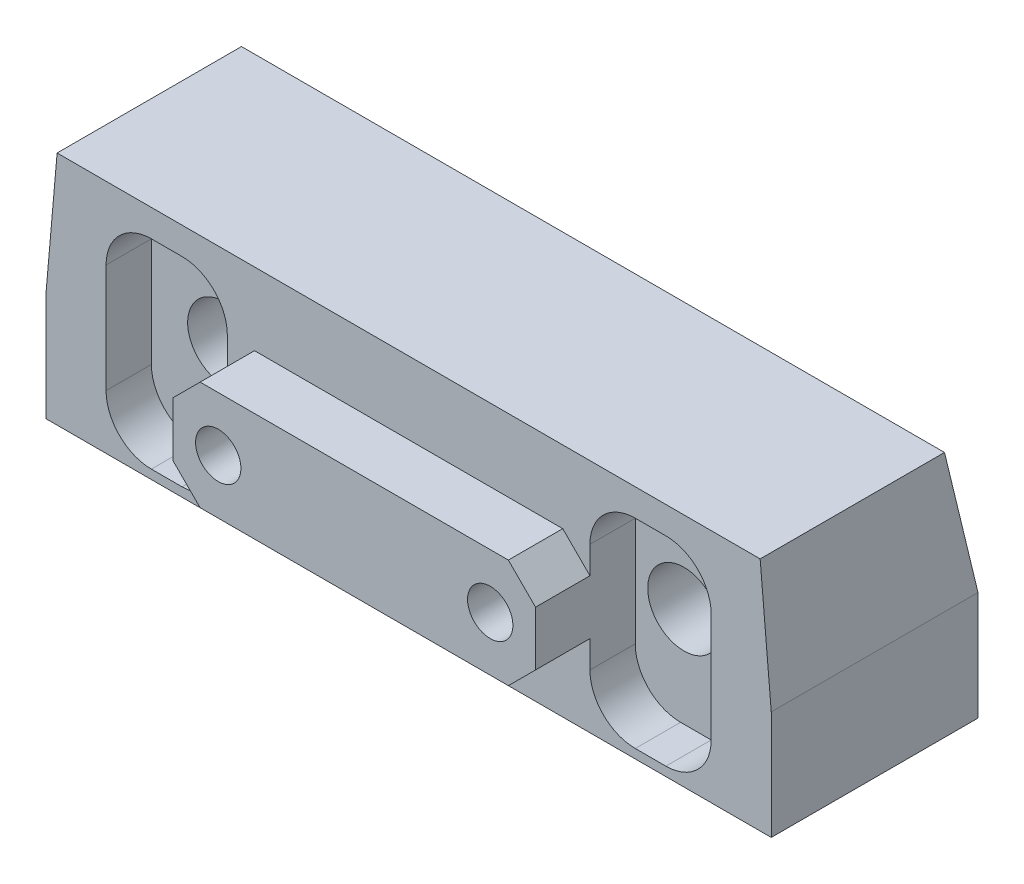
SolidWorks part; units mm, degrees
ref_plane "Plan de face" through (0, 0, 0) normal (0, 0, 1) x (1, 0, 0)
ref_plane "Plan de dessus" through (0, 0, 0) normal (0, 1, 0) x (1, 0, 0)
ref_plane "Plan de droite" through (0, 0, 0) normal (1, 0, 0) x (0, 0, -1)
imported_body "Importée1"
fillet "Congé3" radius 0.5
sketch "Esquisse1" plane through (0, 0, 152) normal (0, 0, 1) x (1, 0, 0)
  line L0 (0, 14) -> (0, -12) construction
  line L1 (-38.7752, 14) -> (38.7752, 14) construction
  line L2 (-26.375, -11) -> (-25, -11)
  line L3 (40, -12) -> (-40, -12) construction
  line L4 (-20, -6) -> (-20, 6)
  line L5 (-25, 11) -> (-26.375, 11)
  line L6 (-26.375, 11) -> (-28.375, 11) construction
  line L7 (-20, 3) -> (-20, -3) construction
  line L8 (-26.375, 11) -> (-26.375, -11)
  line L9 (26.375, 11) -> (26.375, -11)
  line L10 (25, 11) -> (26.375, 11)
  line L11 (20, -6) -> (20, 6)
  line L12 (26.375, -11) -> (25, -11)
  arc A0 (21.375, 6) -> (26.375, 11) centre (26.375, 6) cw construction
  arc A1 (25, -11) -> (20, -6) centre (25, -6) cw
  arc A2 (20, 6) -> (25, 11) centre (25, 6) cw
  arc A3 (-20, 6) -> (-25, 11) centre (-25, 6) ccw
  arc A4 (-21.375, 6) -> (-26.375, 11) centre (-26.375, 6) ccw construction
  arc A5 (-21.375, 6) -> (-26.375, 11) centre (-26.375, 6) ccw construction
  arc A6 (-25, -11) -> (-20, -6) centre (-25, -6) ccw
extrude "Extrusion1" cut sketch "Esquisse1" against normal up to surface (5 mm away)
